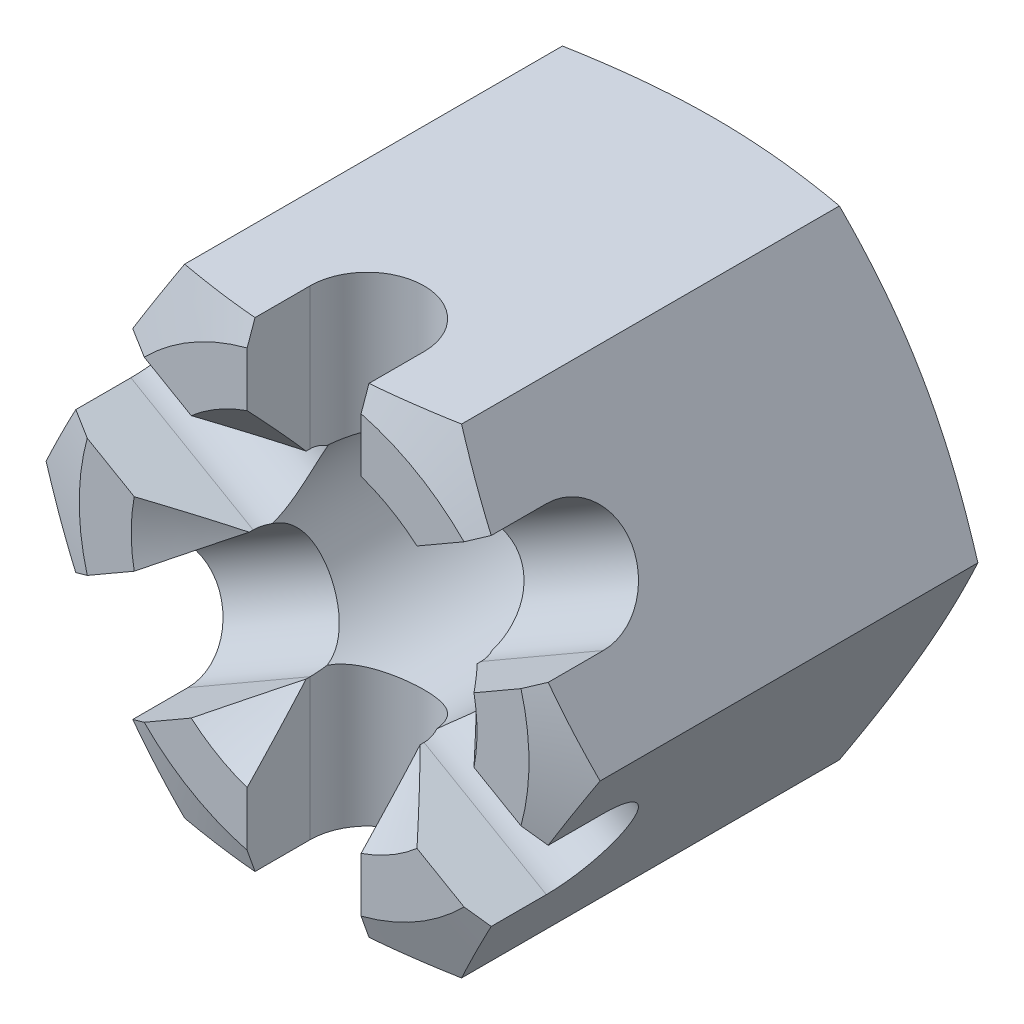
SolidWorks part; units mm, degrees
ref_plane "Front" through (0, 0, 0) normal (0, 0, 1) x (1, 0, 0)
ref_plane "Top" through (0, 0, 0) normal (0, 1, 0) x (1, 0, 0)
ref_plane "Right" through (0, 0, 0) normal (1, 0, 0) x (0, 0, -1)
sketch "Sketch1" plane through (0, 0, 0) normal (0, 0, 1) x (1, 0, 0)
  line L1 (6.9282, -12) -> (13.8564, 0)
  line L2 (13.8564, 0) -> (6.9282, 12)
  line L3 (6.9282, 12) -> (-6.9282, 12)
  line L4 (-6.9282, 12) -> (-13.8564, 0)
  line L5 (-13.8564, 0) -> (-6.9282, -12)
  line L6 (-6.9282, -12) -> (6.9282, -12)
  circle A0 centre (0, 0) radius 12 construction
  dimension "s" = 24
extrude "BaseNut" add sketch "Sketch1" against normal blind 20.8
sketch "Sketch2" plane through (-3.4718, 0, -17.3282) normal (0, 1, 0) x (0, 0, -1)
  line L0 (3.4718, 7.7782) -> (2.5231, 10.3846)
  line L3 (2.5231, 10.3846) -> (3.4718, 10.3846)
  line L4 (3.4718, 10.3846) -> (3.4718, 7.7782)
  line L5 (0, -3.4718) -> (-12.6262, -3.4718) construction
  line L6 (-17.3282, 7.7782) -> (-17.3282, 10.3846)
  line L8 (-17.3282, 10.3846) -> (-16.3795, 10.3846)
  line L9 (-16.3795, 10.3846) -> (-17.3282, 7.7782)
  dimension "dw" = 22.5
  dimension "D2" = 20
  dimension "D3" = 20
revolve "Double-Chamfer" cut sketch "Sketch2" angle 360 about L5
sketch "Sketch3" plane through (2.6208, -2.2475, -20.8) normal (0, 0, -1) x (-1, 0, 0)
  line L0 (2.6208, 2.2475) -> (2.6208, 3.7475) construction
  circle A0 centre (2.6208, 2.2475) radius 5.5
  circle A1 centre (2.6208, 2.2475) radius 11.25 construction
  dimension "D1" = 11
  dimension "D2" = 1.5
extrude "Hole" cut sketch "Sketch3" against normal through all
sketch "Sketch4" plane through (-15.7583, 0, -7.1083) normal (0, 1, 0) x (0, 0, -1)
  line L0 (13.6917, -24.4083) -> (10.5417, -21.2583)
  line L2 (10.5417, -21.2583) -> (13.6917, -21.2583)
  line L3 (13.6917, -21.2583) -> (13.6917, -24.4083)
  line L4 (0, -15.7583) -> (-22.8666, -15.7583) construction
  line L7 (-7.1083, -21.2583) -> (-3.9583, -21.2583)
  line L9 (-3.9583, -21.2583) -> (-7.1083, -24.4083)
  line L10 (-7.1083, -24.4083) -> (-7.1083, -21.2583)
  dimension "D1" = 17.3
  dimension "D2" = 45
  dimension "D3" = 45
revolve "EndChamfer" cut sketch "Sketch4" angle 360 about L4
sketch "Sketch5" plane through (-17.8, 0, -17.8) normal (0, 1, 0) x (0, 0, -1)
  line L0 (-17.8, -14.95) -> (-14.65, -14.95)
  line L2 (-14.65, -20.65) -> (-17.8, -20.65)
  line L3 (-17.8, -20.65) -> (-17.8, -14.95)
  line L5 (-10.6917, -17.8) -> (-33.5583, -17.8) construction
  line L6 (-14.65, -17.8) -> (-0.15, -17.8) construction
  line L7 (3, -26.45) -> (3, -9.15) construction
  line L14 (-17.8, -9.15) -> (-17.8, -26.45) construction
  arc A0 (-14.65, -14.95) -> (-14.65, -20.65) centre (-14.65, -17.8) cw
  point P6 (-11.8, -17.8)
  point P9 (3, -17.8)
  dimension "n" = 5.7
  dimension "W" = 14.8
extrude "Slot" cut sketch "Sketch5" against normal through all
pattern_circular "SlotPattern" count 6 over 360 about axis through (0, 0, 0) along (0, 0, 1) of "Slot"
sketch "Sketch7" plane through (0, 0, 0) normal (0, 1, 0) x (1, 0, 0)
  line L0 (0, 23.693) -> (0, 15.0456) construction
  line L1 (4, 18.4) -> (5.5, 18.4)
  line L2 (5.5, 18.4) -> (6.799, 17.65)
  line L3 (6.799, 17.65) -> (5.5, 16.9)
  line L4 (5.5, 16.9) -> (4, 16.9)
  line L5 (4, 16.9) -> (4, 18.4)
  line L6 (-5.5, 17.65) -> (5.5, 17.65) construction
  dimension "D1" = 1.5
  dimension "D2" = 11
revolve "Cut-Revolve10" [suppressed] cut sketch "Sketch7" angle 360 about L0
pattern_linear "LPattern10" [suppressed] count 10 spacing 1.8 along (0, 0, 1)
equation "\"D1@Sketch3\" = \"D2@ThreadCosmetic1\" - \"D2@Sketch3\" * 2"
equation "\"D2@Sketch7\" = \"D1@Sketch3\""
equation "\"D1@Sketch7\" = (  \"D2@ThreadCosmetic1\" - \"D1@Sketch3\" )  / 2"
equation "\"D3@LPattern10\" = \"D1@Sketch7\" * 1.2"
equation "\"D1@LPattern10\" =  ( \"m@BaseNut\" -  (  \"D1@Sketch4\" - \"D2@Sketch7\")  / 2  ) / \"D3@LPattern10\" "
